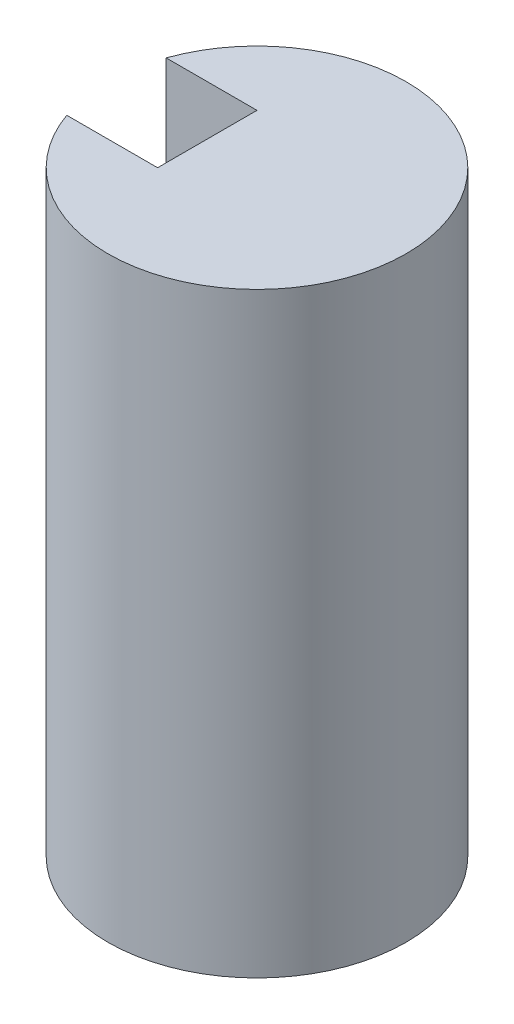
SolidWorks part; units mm, degrees
other "DetailItem3"
other "DetailItem4"
other "DetailItem5"
other "DetailItem6"
other "DetailItem7"
other "DetailItem8"
other "DetailItem9"
other "DetailItem10"
other "DetailItem11"
ref_plane "Front Plane" through (0, 0, 0) normal (0, 0, 1) x (1, 0, 0)
ref_plane "Top Plane" through (0, 0, 0) normal (0, 1, 0) x (1, 0, 0)
ref_plane "Right Plane" through (0, 0, 0) normal (1, 0, 0) x (0, 0, -1)
sketch "Sketch4" plane through (0, 0, 0) normal (1, 0, 0) x (0, 0, -1)
  line L0 (0, 0) -> (0, 3)
  line L1 (0, 3) -> (0, 4.5)
  line L2 (0, 4.5) -> (0, 6)
  line L3 (0, 6) -> (0, 7.5)
  line L4 (0, 7.5) -> (0, 9)
  line L5 (0, 9) -> (0, 10.5)
  line L6 (0, 10.5) -> (0, 12)
  line L7 (0, 12) -> (0, 13.5)
  line L8 (0, 13.5) -> (0, 16.5)
  line L9 (0, 16.5) -> (0, 19.5)
  line L10 (0, 19.5) -> (0, 21)
  line L11 (-1.5, 13.5) -> (1.5, 13.5)
  line L12 (-1.5, 19.5) -> (1.5, 19.5)
  line L13 (0, 21) -> (0, 22.5)
  line L14 (0, 22.5) -> (0, 24)
  line L15 (0, 24) -> (0, 27)
  line L16 (0, 0) -> (0, -1)
  line L17 (0, -1) -> (0, -2.5)
  line L18 (0, -2.5) -> (0, -4)
  line L19 (-1.5, -1) -> (1.5, -1)
  line L20 (-1.5, 3) -> (1.5, 3)
  dimension "D1" = 3
  dimension "D2" = 1.5
  dimension "D3" = 3
  dimension "D4" = 3
  dimension "D5" = 1.5
  dimension "D6" = 3
  dimension "D7" = 1
  dimension "D8" = 1.5
sketch "Sketch3" plane through (0, 0, 0) normal (0, 1, 0) x (1, 0, 0)
  circle A0 centre (1.5, 0) radius 1.5
  dimension "D1" = 3
extrude "Boss-Extrude2" add sketch "Sketch3" along normal up to vertex (6 mm away) contours A0
sketch "Sketch6" plane through (0, 0, 0) normal (1, 0, 0) x (0, 0, -1)
  line L1 (0, 9) -> (0, 10.5) construction
  line L2 (0.5, 3) -> (-0.5, 3)
  line L3 (0.5, 3) -> (0.5, 6)
  line L4 (0.5, 6) -> (-0.5, 6)
  line L5 (-0.5, 3) -> (-0.5, 6)
  line L6 (0.5, 3) -> (-0.5, 6) construction
  line L7 (0.5, 6) -> (-0.5, 3) construction
  point P0 (0, 4.5)
  dimension "D1" = 1
extrude "Cut-Extrude2" cut sketch "Sketch6" along normal blind 1
